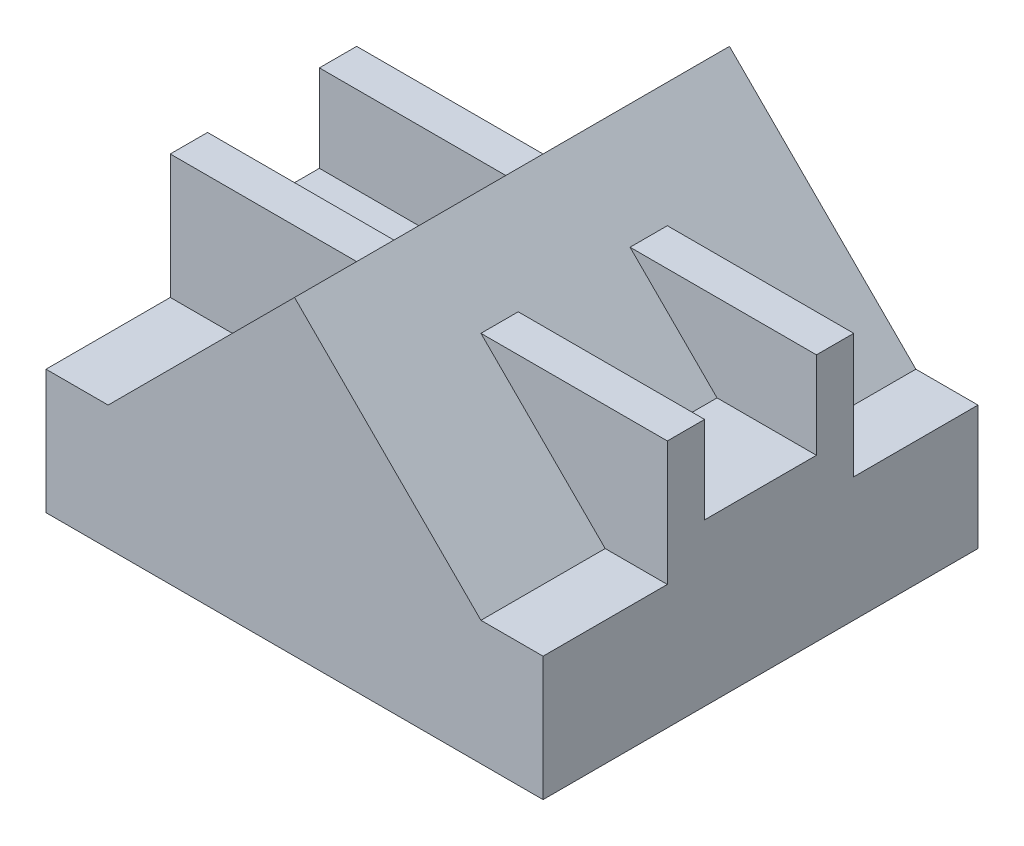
SolidWorks part; units mm, degrees
ref_plane "Front Plane" through (0, 0, 0) normal (0, 0, 1) x (1, 0, 0)
ref_plane "Top Plane" through (0, 0, 0) normal (0, 1, 0) x (1, 0, 0)
ref_plane "Right Plane" through (0, 0, 0) normal (1, 0, 0) x (0, 0, -1)
sketch "Sketch2" plane through (0, 0, 0) normal (0, 1, 0) x (1, 0, 0)
  line L1 (-100, -87.5) -> (100, -87.5)
  line L2 (-100, -87.5) -> (-100, 87.5)
  line L3 (-100, 87.5) -> (100, 87.5)
  line L4 (100, -87.5) -> (100, 87.5)
  line L5 (-100, -87.5) -> (100, 87.5) construction
  line L6 (-100, 87.5) -> (100, -87.5) construction
  point P0 (0, 0)
  dimension "D1" = 175
  dimension "D2" = 200
extrude "Boss-Extrude1" add sketch "Sketch2" along normal blind 50
sketch "Sketch3" plane through (100, 0, 0) normal (1, 0, 0) x (0, 0, -1)
  line L0 (-37.5, 50) -> (-37.5, 100)
  line L1 (-87.5, 50) -> (87.5, 50) construction
  line L2 (-37.5, 100) -> (-22.5, 100)
  line L3 (-22.5, 100) -> (-22.5, 65)
  line L4 (-22.5, 65) -> (22.5, 65)
  line L5 (22.5, 65) -> (22.5, 100)
  line L6 (22.5, 100) -> (37.5, 100)
  line L7 (37.5, 100) -> (37.5, 50)
  line L8 (-87.5, 0) -> (87.5, 0) construction
  line L9 (-37.5, 50) -> (-87.5, 50)
  line L10 (37.5, 50) -> (87.5, 50)
  line L11 (87.5, 50) -> (87.5, 0)
  line L12 (87.5, 0) -> (-87.5, 0)
  line L13 (-87.5, 0) -> (-87.5, 50)
  dimension "D1" = 15
  dimension "D2" = 15
  dimension "D3" = 100
  dimension "D4" = 50
  dimension "D5" = 45
  dimension "D6" = 15
extrude "Boss-Extrude2" add sketch "Sketch3" against normal up to vertex (200 mm away)
sketch "Sketch5" plane through (0, 0, 87.5) normal (0, 0, 1) x (1, 0, 0)
  line L0 (0, 0) -> (0, 125) construction
  line L1 (75, 50) -> (0, 125)
  line L2 (100, 50) -> (100, 0)
  line L3 (100, 0) -> (-100, 0)
  line L4 (-100, 0) -> (-100, 50)
  line L5 (-100, 50) -> (-75, 50)
  line L6 (-100, 50) -> (100, 50) construction
  line L7 (-75, 50) -> (0, 125)
  line L11 (75, 50) -> (100, 50)
  dimension "D1" = 125
  dimension "D2" = 45
extrude "Boss-Extrude3" add sketch "Sketch5" against normal through all
